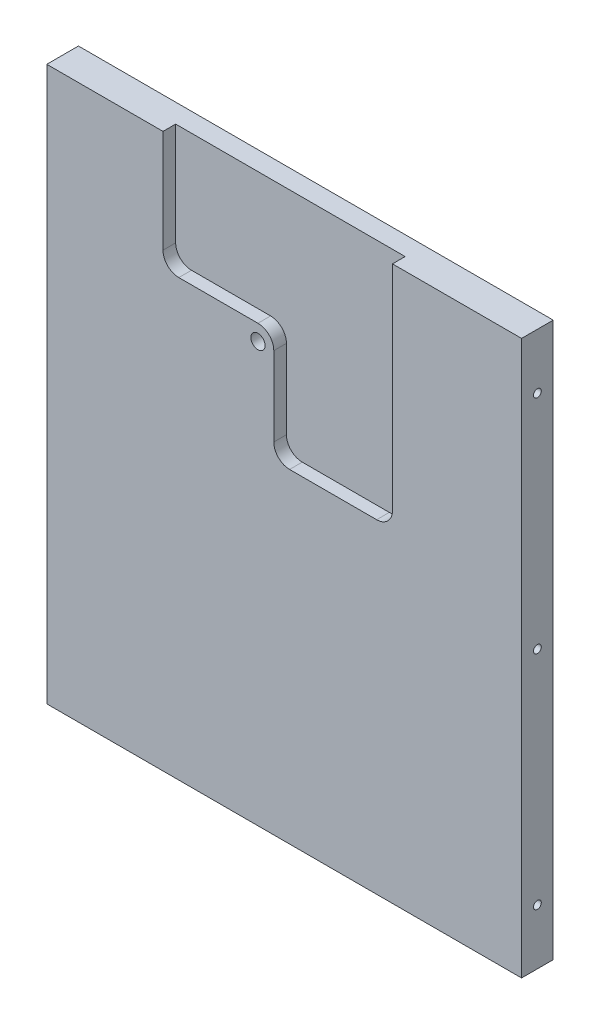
SolidWorks part; units mm, degrees
ref_plane "Ebene vorne" through (0, 0, 0) normal (0, 0, 1) x (1, 0, 0)
ref_plane "Ebene oben" through (0, 0, 0) normal (0, 1, 0) x (1, 0, 0)
ref_plane "Ebene rechts" through (0, 0, 0) normal (1, 0, 0) x (0, 0, -1)
sketch "Skizze1" plane through (0, 0, 0) normal (0, 0, 1) x (1, 0, 0)
  line L1 (-96.1409, 69.4002) -> (53.8591, 69.4002)
  line L2 (-96.1409, 69.4002) -> (-96.1409, -105.5998)
  line L3 (-96.1409, -105.5998) -> (53.8591, -105.5998)
  line L4 (53.8591, 69.4002) -> (53.8591, -105.5998)
  dimension "D1" = 150
  dimension "D2" = 175
extrude "Aufsatz-Linear austragen1" add sketch "Skizze1" along normal blind 10
sketch "Skizze2" plane through (0, 0, 10) normal (0, 0, 1) x (1, 0, 0)
  line L0 (-96.1409, -18.0998) -> (53.8591, -18.0998) construction
  line L1 (-96.1409, 69.4002) -> (-96.1409, -105.5998) construction
  line L2 (-96.1409, -18.0998) -> (33.5831, 69.4002) construction
  line L3 (53.8591, 69.4002) -> (-96.1409, 69.4002) construction
  line L4 (-96.1409, -18.0998) -> (33.5831, -105.5998) construction
  line L5 (-96.1409, -105.5998) -> (53.8591, -105.5998) construction
  line L6 (-29.4257, 26.9002) -> (53.8591, 26.9002) construction
  line L11 (53.8591, -105.5998) -> (53.8591, 69.4002) construction
  line L12 (-29.4257, -63.0998) -> (-29.4257, 26.9002) construction
  line L13 (53.8591, -8.0998) -> (-96.1409, -8.0998) construction
  line L14 (53.8591, -28.0998) -> (-96.1409, -28.0998) construction
  line L15 (-21.1409, -28.0998) -> (-21.1409, -8.0998) construction
  circle A0 centre (-29.4257, 26.9002) radius 2.25
  point P29 (-21.1409, -18.0998)
  dimension "D4" = 4.5
  dimension "D1" = 34
  dimension "D2" = 34
  dimension "D3" = 90
  dimension "D10" = 20
extrude "Schnitt-Linear austragen1" cut sketch "Skizze2" against normal blind 10
sketch "Skizze3" plane through (0, 0, 10) normal (0, 0, 1) x (1, 0, 0)
  line L1 (-54.4257, 31.9002) -> (-54.4257, 69.4002) construction
  line L7 (-54.4257, 31.9002) -> (-29.4257, 31.9002)
  line L8 (-24.4257, 26.9002) -> (-24.4257, 1.9002)
  line L9 (-19.4257, -3.0998) -> (8.0743, -3.0998)
  line L10 (13.0743, 1.9002) -> (13.0743, 69.4002)
  line L11 (53.8591, 69.4002) -> (-96.1409, 69.4002) construction
  line L12 (-59.4257, 36.9002) -> (-59.4257, 69.4002)
  line L13 (-59.4257, 69.4002) -> (13.0743, 69.4002)
  line L14 (-24.4257, 1.9002) -> (13.0743, 1.9002) construction
  arc A3 (-29.4257, 31.9002) -> (-24.4257, 26.9002) centre (-29.4257, 26.9002) cw
  arc A4 (-24.4257, 1.9002) -> (-19.4257, -3.0998) centre (-19.4257, 1.9002) ccw
  arc A5 (8.0743, -3.0998) -> (13.0743, 1.9002) centre (8.0743, 1.9002) ccw
  arc A6 (-54.4257, 31.9002) -> (-59.4257, 36.9002) centre (-54.4257, 36.9002) cw
  circle A7 centre (-29.4257, 26.9002) radius 2.25 construction
  dimension "D1" = 5
  dimension "D2" = 25
  dimension "D3" = 25
extrude "Schnitt-Linear austragen2" cut sketch "Skizze3" against normal blind 4
sketch "Skizze4" plane through (-96.1409, 0, 0) normal (-1, 0, 0) x (0, 0, 1)
  line L0 (0, -18.0998) -> (10, -18.0998) construction
  line L1 (5, -88.0998) -> (5, -18.0998) construction
  line L2 (5, -18.0998) -> (5, 51.9002) construction
  line L4 (10, 69.4002) -> (10, -105.5998) construction
  line L5 (0, 69.4002) -> (0, -105.5998) construction
  circle A0 centre (5, 51.9002) radius 1.23
  circle A1 centre (5, -18.0998) radius 1.23
  circle A3 centre (5, -88.0998) radius 1.23
  point P7 (5, -18.0998)
  dimension "D2" = 2.46
  dimension "D1" = 70
extrude "Schnitt-Linear austragen3" cut sketch "Skizze4" against normal blind 5
sketch "Skizze6" plane through (53.8591, 0, 0) normal (1, 0, 0) x (0, 0, -1)
  line L0 (-10, -18.0998) -> (0, -18.0998) construction
  line L1 (-5, -88.0998) -> (-5, -18.0998) construction
  line L2 (-5, -18.0998) -> (-5, 51.9002) construction
  line L4 (0, -105.5998) -> (0, 69.4002) construction
  line L5 (-10, -105.5998) -> (-10, 69.4002) construction
  circle A0 centre (-5, 51.9002) radius 1.23
  circle A1 centre (-5, -18.0998) radius 1.23
  circle A3 centre (-5, -88.0998) radius 1.23
  point P7 (-5, -18.0998)
  dimension "D2" = 2.46
  dimension "D1" = 70
extrude "Schnitt-Linear austragen4" cut sketch "Skizze6" against normal blind 5
sketch "Skizze7" plane through (0, -105.5998, 0) normal (0, -1, 0) x (1, 0, 0)
  line L0 (-29.4209, 0) -> (-29.4209, 10) construction
  line L1 (-96.1409, 0) -> (53.8591, 0) construction
  line L2 (-96.1409, 10) -> (53.8591, 10) construction
  line L3 (-96.1409, 10) -> (-96.1409, 0) construction
  circle A0 centre (-29.4209, 5) radius 1
  dimension "D1" = 2
  dimension "D2" = 66.72
